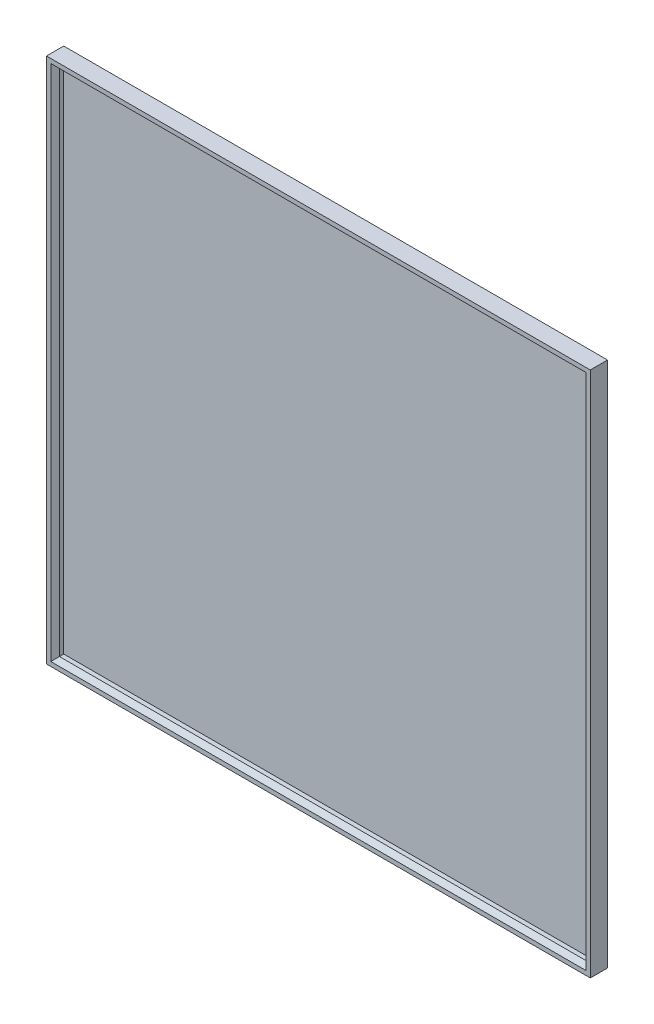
SolidWorks part; units mm, degrees
ref_plane "前基準面" through (0, 0, 0) normal (0, 0, 1) x (1, 0, 0)
ref_plane "上基準面" through (0, 0, 0) normal (0, 1, 0) x (1, 0, 0)
ref_plane "右基準面" through (0, 0, 0) normal (1, 0, 0) x (0, 0, -1)
sketch "草圖1" plane through (0, 0, 0) normal (0, 0, 1) x (1, 0, 0)
  line L1 (0, 0) -> (630, 0)
  line L2 (0, 0) -> (0, -610)
  line L3 (0, -610) -> (630, -610)
  line L8 (630, 0) -> (630, -610)
  dimension "D1" = 610
  dimension "D2" = 630
extrude "填料-伸長1" add sketch "草圖1" along normal blind 20
shell "薄殼2" thickness 10
shell "薄殼4" thickness 10
chamfer "導角1" distance 5 angle 45 4 edges at (315, -600, 20) (620, -305, 20) (10, -305, 20) (315, -10, 20)
sketch "草圖4" plane through (0, 0, 2) normal (0, 0, -1) x (-1, 0, 0)
  line L0 (0, 0) -> (0, -610) construction
  line L1 (-140, -150) -> (-60, -150)
  line L2 (-150, -160) -> (-150, -180)
  line L3 (-140, -190) -> (-60, -190)
  line L4 (-50, -160) -> (-50, -180)
  line L5 (-570, -150) -> (-490, -150)
  line L6 (-580, -160) -> (-580, -180)
  line L7 (-570, -190) -> (-490, -190)
  line L8 (-480, -160) -> (-480, -180)
  line L9 (-630, 0) -> (0, 0) construction
  line L10 (-630, -610) -> (-630, 0) construction
  arc A0 (-60, -190) -> (-50, -180) centre (-60, -180) ccw
  arc A1 (-50, -160) -> (-60, -150) centre (-60, -160) ccw
  arc A2 (-140, -190) -> (-150, -180) centre (-140, -180) cw
  arc A3 (-150, -160) -> (-140, -150) centre (-140, -160) cw
  arc A4 (-480, -180) -> (-490, -190) centre (-490, -180) cw
  arc A5 (-480, -160) -> (-490, -150) centre (-490, -160) ccw
  arc A6 (-580, -180) -> (-570, -190) centre (-570, -180) ccw
  arc A7 (-580, -160) -> (-570, -150) centre (-570, -160) cw
  point P16 (-50, -150)
  point P19 (-150, -190)
  point P22 (-150, -150)
  point P27 (-480, -150)
  point P30 (-580, -190)
  point P33 (-580, -150)
  dimension "D8" = 10
  dimension "D1" = 100
  dimension "D2" = 100
  dimension "D3" = 40
  dimension "D4" = 40
  dimension "D5" = 50
  dimension "D6" = 50
  dimension "D7" = 150
  dimension "D9" = 150
extrude "填料-伸長3" add sketch "草圖4" along normal blind 20
sketch "草圖5" plane through (0, 0, -18) normal (0, 0, -1) x (-1, 0, 0)
  line L0 (-480, -180) -> (-480, -160) construction
  line L1 (-565, -170) -> (-495, -170)
  line L2 (-565, -170) -> (-565, -180)
  line L3 (-560, -185) -> (-500, -185)
  line L4 (-495, -170) -> (-495, -180)
  line L5 (-135, -170) -> (-65, -170)
  line L6 (-135, -170) -> (-135, -180)
  line L7 (-130, -185) -> (-70, -185)
  line L8 (-65, -170) -> (-65, -180)
  line L9 (-490, -150) -> (-570, -150) construction
  line L10 (-60, -150) -> (-140, -150) construction
  line L11 (-150, -160) -> (-150, -180) construction
  arc A1 (-65, -180) -> (-70, -185) centre (-70, -180) cw
  arc A2 (-135, -180) -> (-130, -185) centre (-130, -180) ccw
  arc A3 (-495, -180) -> (-500, -185) centre (-500, -180) cw
  arc A4 (-565, -180) -> (-560, -185) centre (-560, -180) ccw
  dimension "D7" = 5
  dimension "D1" = 70
  dimension "D2" = 70
  dimension "D3" = 15
  dimension "D4" = 20
  dimension "D5" = 20
  dimension "D6" = 15
  dimension "D8" = 15
  dimension "D9" = 15
extrude "除料-伸長2" cut sketch "草圖5" against normal blind 20
